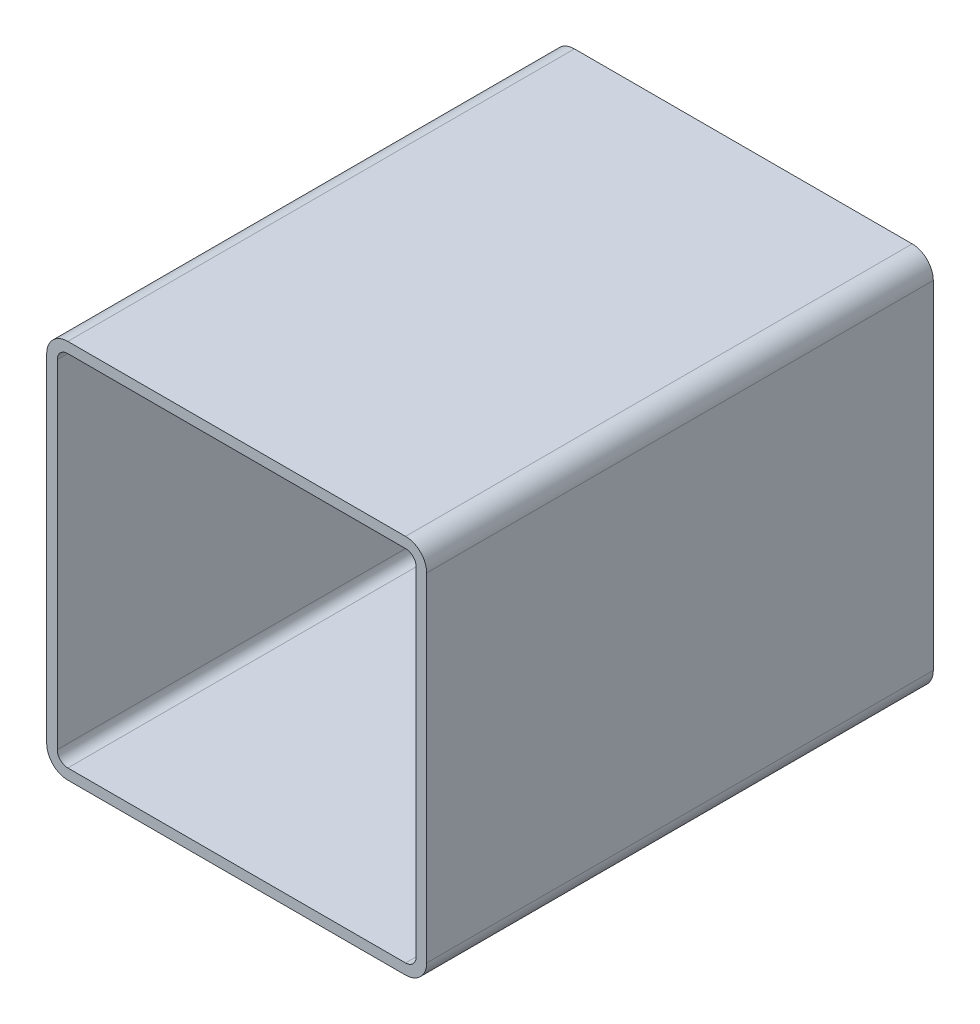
SolidWorks part; units mm, degrees
ref_plane "Front Plane" through (0, 0, 0) normal (0, 0, 1) x (1, 0, 0)
ref_plane "Top Plane" through (0, 0, 0) normal (0, 1, 0) x (1, 0, 0)
ref_plane "Right Plane" through (0, 0, 0) normal (1, 0, 0) x (0, 0, -1)
sketch "Sketch1" plane through (0, 0, 0) normal (0, 0, 1) x (1, 0, 0)
sketch_block_instance "HSS9x9x0.250-1"
sketch_block "HSS9x9x0.250"
extrude "Boss-Extrude1" add sketch "Sketch1" along normal blind 304.8
